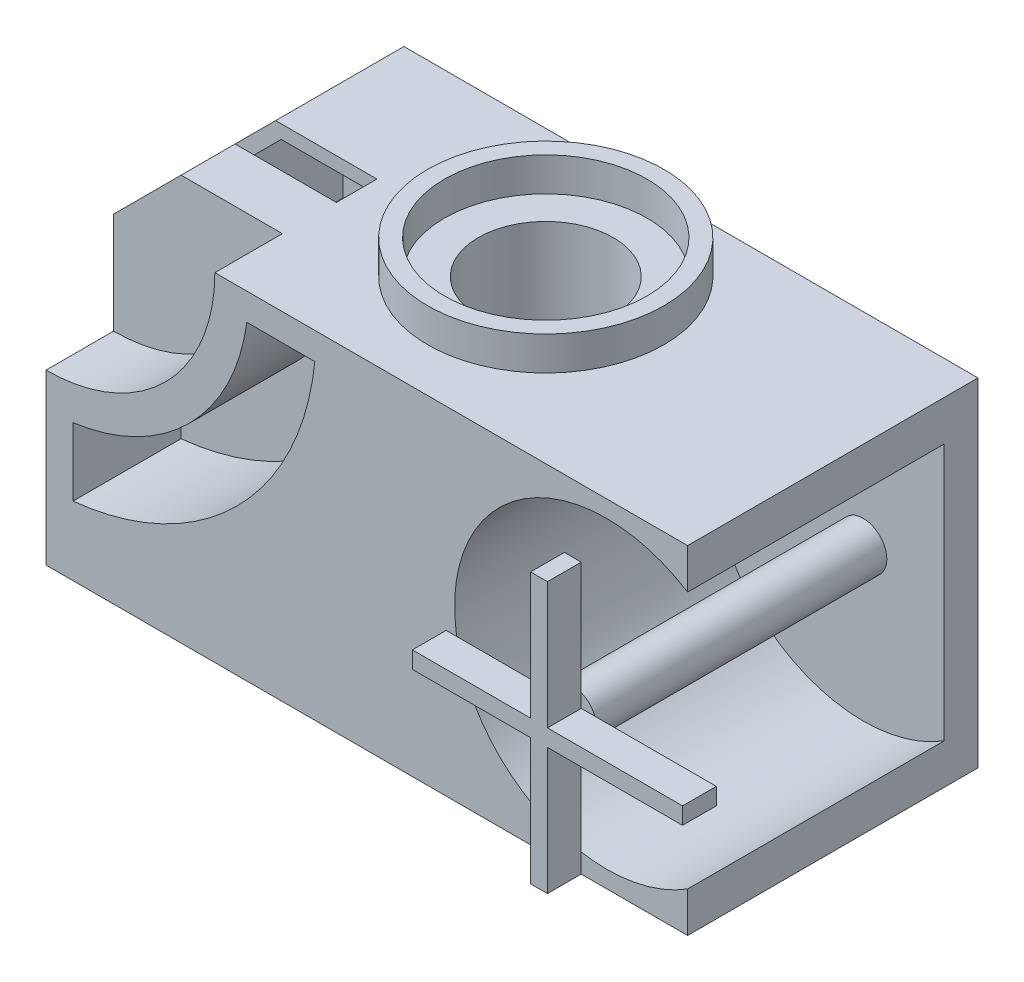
SolidWorks part; units mm, degrees
ref_plane "Front Plane" through (0, 0, 0) normal (0, 0, 1) x (1, 0, 0)
ref_plane "Top Plane" through (0, 0, 0) normal (0, 1, 0) x (1, 0, 0)
ref_plane "Right Plane" through (0, 0, 0) normal (1, 0, 0) x (0, 0, -1)
sketch "Sketch2" plane through (0, 0, 0) normal (0, 0, 1) x (1, 0, 0)
  line L0 (0, 0) -> (63.6397, 0)
  line L1 (6.3603, 0) -> (10, 10) construction
  line L2 (10, 10) -> (60, 10) construction
  line L3 (60, 10) -> (63.6397, 0) construction
  line L4 (63.6397, 0) -> (95, 0)
  line L5 (95, 0) -> (95, 50)
  line L6 (95, 50) -> (0, 50)
  line L7 (0, 50) -> (0, 0)
extrude "Boss-Extrude1" add sketch "Sketch2" against normal blind 43
sketch "Sketch3" plane through (0, 0, 0) normal (0, 0, 1) x (1, 0, 0)
  line L0 (0, 50) -> (0, 0) construction
  line L1 (95, 50) -> (0, 50) construction
  arc A0 (0, 25) -> (25, 50) centre (0, 50) ccw
  dimension "D1" = 25
extrude "Cut-Extrude1" cut sketch "Sketch3" against normal blind 24 and the other way through all
sketch "Sketch4" plane through (0, 0, 0) normal (0, 0, 1) x (1, 0, 0)
  line L0 (29.7321, 46) -> (39.7995, 46)
  line L1 (4, 20.2679) -> (4, 10.2005)
  line L2 (0, 25) -> (0, 0) construction
  line L3 (95, 50) -> (25, 50) construction
  arc A0 (4, 20.2679) -> (29.7321, 46) centre (0, 50) ccw
  arc A1 (39.7995, 46) -> (4, 10.2005) centre (0, 50) cw
  dimension "D1" = 30
  dimension "D2" = 40
  dimension "D3" = 4
  dimension "D4" = 4
extrude "Cut-Extrude2" cut sketch "Sketch4" against normal blind 16
chamfer "Chamfer1" distance 10 angle 45 1 edges at (0, 50, -33.5)
sketch "Sketch5" plane through (0, 0, 0) normal (0, 0, 1) x (1, 0, 0)
  line L0 (95, 50) -> (25, 50) construction
  line L1 (95, 0) -> (95, 50) construction
  circle A0 centre (83, 25) radius 22.5
  point P6 (76.5109, 57.5172)
  dimension "D1" = 45
  dimension "D2" = 25
  dimension "D3" = 12
extrude "Cut-Extrude3" cut sketch "Sketch5" along direction (0, 0, 1) on the side against the normal offset from surface (38 mm away) 5
sketch "Sketch6" plane through (0, 0, -38) normal (0, 0, 1) x (1, 0, 0)
  circle A0 centre (83, 25) radius 3.5
  dimension "D1" = 7
extrude "Boss-Extrude2" add sketch "Sketch6" along normal offset from surface (43 mm away) 5
sketch "Sketch7" plane through (0, 0, 5) normal (0, 0, 1) x (1, 0, 0)
  line L1 (84.25, 5) -> (81.75, 5)
  line L2 (84.25, 5) -> (84.25, 45)
  line L3 (84.25, 45) -> (81.75, 45)
  line L4 (81.75, 5) -> (81.75, 45)
  line L5 (84.25, 5) -> (81.75, 45) construction
  line L6 (84.25, 45) -> (81.75, 5) construction
  line L7 (104.25, 23.75) -> (64.25, 23.75)
  line L8 (104.25, 23.75) -> (104.25, 26.25)
  line L9 (104.25, 26.25) -> (64.25, 26.25)
  line L10 (64.25, 23.75) -> (64.25, 26.25)
  line L11 (104.25, 23.75) -> (64.25, 26.25) construction
  line L12 (104.25, 26.25) -> (64.25, 23.75) construction
  point P0 (83, 25)
  point P6 (84.25, 25)
  dimension "D1" = 40
  dimension "D2" = 40
  dimension "D3" = 2.5
  dimension "D4" = 2.5
extrude "Boss-Extrude3" add sketch "Sketch7" along normal blind 5 contours L2 L7 L4 M1 | L4 L1 L2 M1 | L10 L7 L9 M1 | L4 L9 L7 M1 | L2 L9 L4 L7 | L9 L2 L7 M1 | L8 L9 L7 M1 | L9 L2 L4 M1 | L4 L2 L3 M1
sketch "Sketch8" plane through (0, 50, 0) normal (0, 1, 0) x (1, 0, 0)
  line L0 (0, 0) -> (0, 24) construction
  circle A0 centre (50, 24) radius 10
  dimension "D1" = 20
  dimension "D2" = 50
extrude "Cut-Extrude4" cut sketch "Sketch8" against normal through all
sketch "Sketch9" plane through (0, 50, 0) normal (0, 1, 0) x (1, 0, 0)
  circle A0 centre (50, 24) radius 15
  circle A1 centre (50, 24) radius 17.5
  dimension "D1" = 30
  dimension "D2" = 35
extrude "Boss-Extrude4" add sketch "Sketch9" along normal blind 5
sketch "Sketch10" plane through (0, 0, -24) normal (0, 0, 1) x (1, 0, 0)
  line L6 (22.9129, 48) -> (10.8284, 48)
  line L7 (10.8284, 48) -> (2, 39.1716)
  line L8 (2, 39.1716) -> (2, 27.0871)
  line L9 (22.9129, 48) -> (10.8284, 48)
  line L10 (10.8284, 48) -> (2, 39.1716)
  line L11 (2, 39.1716) -> (2, 27.0871)
  arc A2 (2, 27.0871) -> (22.9129, 48) centre (0, 50) ccw
  arc A3 (2, 27.0871) -> (22.9129, 48) centre (0, 50) ccw
  dimension "D1" = 2
extrude "Cut-Extrude5" cut sketch "Sketch10" against normal offset from surface (18 mm away) 1
sketch "Sketch11" plane through (0, 0, -24) normal (0, 0, 1) x (1, 0, 0)
  line L0 (0, 40) -> (0, 25) construction
  line L1 (10, 50) -> (0, 40) construction
  line L2 (25, 50) -> (10, 50) construction
  line L3 (0, 40) -> (0, 25)
  line L4 (10, 50) -> (0, 40)
  line L5 (25, 50) -> (10, 50)
  arc A0 (0, 25) -> (25, 50) centre (0, 50) ccw construction
  arc A1 (0, 25) -> (25, 50) centre (0, 50) ccw
extrude "Boss-Extrude5" add sketch "Sketch11" along normal blind 8 from offset 6
equation "\"A\" = 95"
equation "\"B\" = 50"
equation "\"C\"= 43"
equation "\"D1@Sketch2\"=\"A\""
equation "\"D2@Sketch2\"=\"B\""
equation "\"D1@Boss-Extrude1\"=\"C\""
